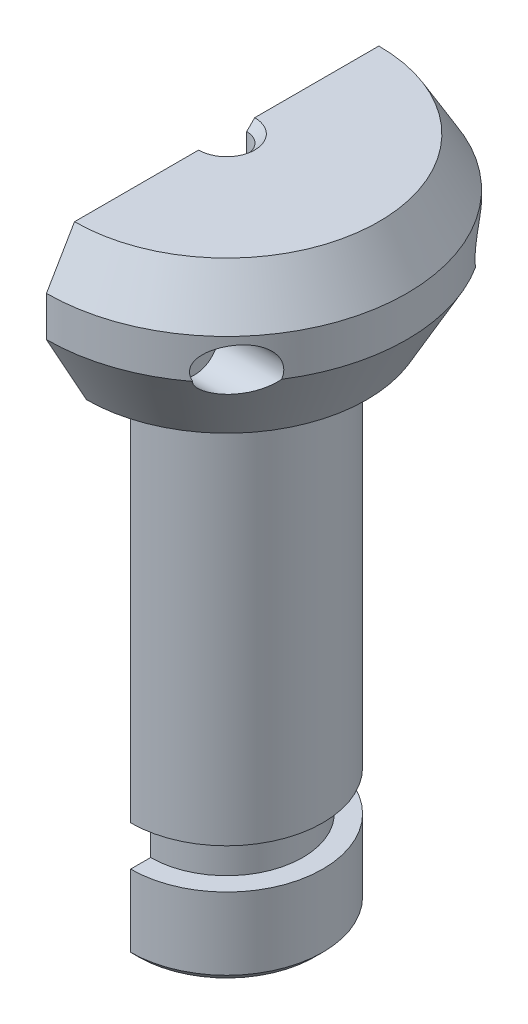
SolidWorks part; units mm, degrees
ref_plane "Plan de face" through (0, 0, 0) normal (0, 0, 1) x (1, 0, 0)
ref_plane "Plan de dessus" through (0, 0, 0) normal (0, 1, 0) x (1, 0, 0)
ref_plane "Plan de droite" through (0, 0, 0) normal (1, 0, 0) x (0, 0, -1)
sketch "Esquisse1" plane through (0, 0, 0) normal (0, 1, 0) x (1, 0, 0)
  circle A0 centre (0, 0) radius 45
  circle A1 centre (0, 0) radius 5
  dimension "D1" = 90
  dimension "D2" = 10
extrude "Boss.-Extru.1" add sketch "Esquisse1" along normal blind 40
sketch "Esquisse2" plane through (0, 40, 0) normal (0, 1, 0) x (-1, 0, 0)
  line L0 (0, -45) -> (0, 45)
  circle A0 centre (0, 0) radius 45 construction
  circle A1 centre (0, 0) radius 45 construction
  arc A2 (0, -45) -> (0, 45) centre (0, 0) ccw
extrude "Enlèv. mat.-Extru.1" cut sketch "Esquisse2" against normal through all
chamfer "Chanfrein1" distance 12 distance2 7 1 edges at (45, 40, 0)
chamfer "Chanfrein4" distance 10 distance2 18 1 edges at (45, 0, 0)
sketch "Esquisse3" plane through (0, 0, 0) normal (0, -1, 0) x (1, 0, 0)
  line L0 (0, -5) -> (0, -24)
  line L1 (0, -5) -> (0, -35) construction
  line L2 (0, 5) -> (0, 24)
  line L3 (0, 35) -> (0, 5) construction
  arc A0 (0, -5) -> (0, 5) centre (0, 0) ccw
  arc A1 (0, -24) -> (0, 24) centre (0, 0) ccw
  dimension "D3" = 0
  dimension "D4" = 5
  dimension "D1" = 24
  dimension "D2" = 24
extrude "Boss.-Extru.2" add sketch "Esquisse3" along normal blind 127
ref_plane "Plan1" through (40, 0, 0) normal (1, 0, 0) x (0, 0, -1)
sketch "Esquisse5" plane through (40, 0, 0) normal (1, 0, 0) x (0, 0, -1)
  line L0 (45, 18) -> (45, 28) construction
  line L4 (38, 40) -> (-38, 40) construction
  line L6 (-38, 40) -> (-5, 40) construction
  line L7 (-45, 18) -> (-45, 28) construction
  circle A0 centre (-30, 20) radius 6.12
  circle A1 centre (30, 20) radius 6.12
  dimension "D1" = 15
  dimension "D2" = 20
  dimension "D3" = 12.24
  dimension "D4" = 12.24
  dimension "D5" = 20
  dimension "D6" = 15
extrude "Enlèv. mat.-Extru.4" cut sketch "Esquisse5" against normal blind 18
chamfer "Chanfrein2" distance 2 angle 45 2 edges at (5, 40, 0) (5, -127, 0)
sketch "Esquisse6" plane through (22, 0, 0) normal (1, 0, 0) x (0, 0, -1)
  circle A0 centre (-30, 20) radius 2.9
  circle A1 centre (30, 20) radius 2.9
  circle A2 centre (-30, 20) radius 6.12 construction
  dimension "D1" = 5.8
  dimension "D2" = 5.8
  dimension "D3" = 0
extrude "Enlèv. mat.-Extru.5" cut sketch "Esquisse6" against normal through all
sketch "Esquisse7" plane through (0, 0, 0) normal (-1, 0, 0) x (0, 0, 1)
  line L0 (24, -127) -> (24, 0) construction
  line L6 (24, -127) -> (7, -127) construction
  line L7 (24, -97) -> (19, -97)
  line L8 (24, -97) -> (24, -107)
  line L9 (24, -107) -> (19, -107)
  line L10 (19, -97) -> (19, -107)
  line L11 (0, 49.1276) -> (0, -137.8507) construction
  dimension "D4" = 5
  dimension "D5" = 10
  dimension "D6" = 20
revolve "Enlèvement de matière-Révolution1" cut sketch "Esquisse7" angle 180 about L11
chamfer "Chanfrein3" distance 2 angle 45 1 edges at (24, -127, 0)
